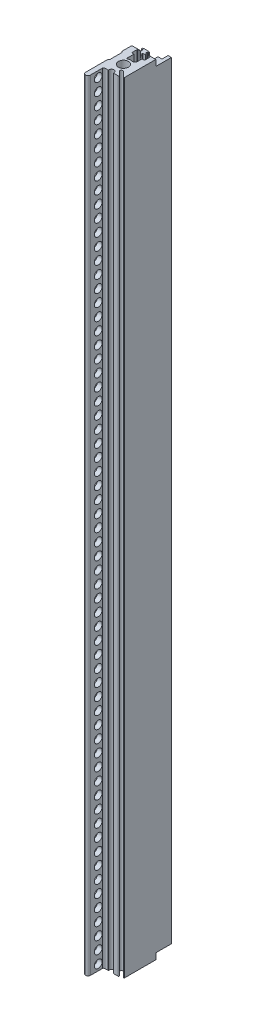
SolidWorks part; units mm, degrees
ref_plane "前视基准面" through (0, 0, 0) normal (0, 0, 1) x (1, 0, 0)
ref_plane "上视基准面" through (0, 0, 0) normal (0, 1, 0) x (1, 0, 0)
ref_plane "右视基准面" through (0, 0, 0) normal (1, 0, 0) x (0, 0, -1)
sketch "草图1" plane through (0, 0, 0) normal (0, 1, 0) x (1, 0, 0)
  line L0 (-4.2, 11.9) -> (-3.9, 11.9)
  line L1 (-4.4, 12.2) -> (-4.4, 12.1)
  line L2 (-4.0328, 12.4) -> (-4.2, 12.4)
  line L3 (-3.85, 12.5) -> (-3.8914, 12.4586)
  line L4 (-2.05, 12.5) -> (-3.85, 12.5)
  line L5 (-2.0086, 12.4586) -> (-2.05, 12.5)
  line L6 (-1.7, 12.4) -> (-1.8672, 12.4)
  line L7 (-1.5, 12.1) -> (-1.5, 12.2)
  line L8 (-1.8, 11.9) -> (-1.7, 11.9)
  line L9 (-2, 11.4828) -> (-2, 11.7)
  line L10 (-1.3586, 10.7586) -> (-1.9414, 11.3414)
  line L11 (-1.3, 10.55) -> (-1.3, 10.6172)
  line L12 (-3.7, 11.7) -> (-3.7, 9.95)
  line L13 (-5, -10.75) -> (-5, -1.6)
  line L14 (-3, -10.75) -> (-3, -5.75)
  line L15 (-2.5, -5.25) -> (-1.15, -5.25)
  line L16 (1.6887, -3.3855) -> (3.2118, -4.9086)
  line L17 (2.5373, -2.537) -> (4.6586, -4.6583)
  line L18 (5, 15) -> (5, 5.1793)
  line L19 (3.6, 15) -> (5, 15)
  line L20 (3.6, 12.5) -> (3.6, 15)
  line L21 (1.95, 12.5) -> (3.6, 12.5)
  line L22 (1.95, 10.55) -> (1.95, 12.5)
  line L23 (2.85, 10.55) -> (1.95, 10.55)
  line L24 (2.85, 9.35) -> (2.85, 10.55)
  line L25 (1.95, 9.35) -> (2.85, 9.35)
  line L26 (1.95, 8.35) -> (1.95, 9.35)
  line L27 (2.85, 8.35) -> (1.95, 8.35)
  line L28 (2.85, 6.05) -> (2.85, 8.35)
  line L29 (1.95, 6.05) -> (2.85, 6.05)
  line L30 (1.95, 3.8856) -> (1.95, 6.05)
  line L31 (-1.45, 6.05) -> (-1.45, 2.9458)
  line L32 (-2.35, 6.05) -> (-1.45, 6.05)
  line L33 (-2.35, 8.35) -> (-2.35, 6.05)
  line L34 (-1.45, 8.35) -> (-2.35, 8.35)
  line L35 (-1.45, 9.35) -> (-1.45, 8.35)
  line L36 (-2.35, 9.35) -> (-1.45, 9.35)
  line L37 (-2.35, 10.55) -> (-2.35, 9.35)
  line L38 (-1.3, 10.55) -> (-2.35, 10.55)
  line L39 (-4.45, 7.7) -> (-4.7, 7.7) construction
  line L40 (-5, 7.4) -> (-4.7, 7.7) construction
  line L41 (-5, 4.4) -> (-5, 7.4)
  line L42 (-4.5499, 3.8998) -> (-5, 4.4)
  line L43 (-4.45, 8.5) -> (-4.45, 9.55)
  line L44 (-3.9, 9.75) -> (-4.25, 9.75)
  line L45 (-4.5499, 3.8998) -> (-4.5501, -1.1002)
  line L46 (-5, -1.6) -> (-4.5501, -1.1002)
  line L47 (4.9414, -1.9395) -> (4.2929, -1.291) construction
  line L48 (5, -2.081) -> (5, -4.5169)
  line L49 (0, 0) -> (0, -5) construction
  line L50 (4, -0.5839) -> (4, 3.6823) construction
  line L51 (-1.05, -5) -> (-1.05, -5.15)
  line L52 (1.05, -5) -> (1.05, -5.15)
  line L53 (1.15, -5.25) -> (3.0703, -5.25)
  line L54 (2.5373, -2.537) -> (1.6887, -3.3855) construction
  line L55 (5, 5.1793) -> (5, -2.081)
  line L56 (-4.45, 8.5) -> (-4.7, 8.5)
  line L57 (-4.7, 8.5) -> (-5, 8.2)
  line L58 (4.9414, 5.0379) -> (4.2929, 4.3894) construction
  line L59 (-5, 8.2) -> (-5, 7.4)
  circle A0 centre (0, 0) radius 1.6
  arc A1 (-4.4, 12.1) -> (-4.2, 11.9) centre (-4.2, 12.1) ccw
  arc A2 (-4.2, 12.4) -> (-4.4, 12.2) centre (-4.2, 12.2) ccw
  arc A3 (-4.0328, 12.4) -> (-3.8914, 12.4586) centre (-4.0328, 12.6) ccw
  arc A4 (-2.0086, 12.4586) -> (-1.8672, 12.4) centre (-1.8672, 12.6) ccw
  arc A5 (-1.5, 12.2) -> (-1.7, 12.4) centre (-1.7, 12.2) ccw
  arc A6 (-1.7, 11.9) -> (-1.5, 12.1) centre (-1.7, 12.1) ccw
  arc A7 (-1.8, 11.9) -> (-2, 11.7) centre (-1.8, 11.7) ccw
  arc A8 (-2, 11.4828) -> (-1.9414, 11.3414) centre (-1.8, 11.4828) ccw
  arc A9 (-1.3, 10.6172) -> (-1.3586, 10.7586) centre (-1.5, 10.6172) ccw
  arc A10 (-5, -10.75) -> (-3, -10.75) centre (-4, -10.75) ccw
  arc A11 (3.0703, -5.25) -> (3.2118, -4.9086) centre (3.0703, -5.05) ccw
  arc A12 (-4.25, 9.75) -> (-4.45, 9.55) centre (-4.25, 9.55) ccw
  arc A13 (-3.9, 9.75) -> (-3.7, 9.95) centre (-3.9, 9.95) ccw
  arc A14 (5, -2.081) -> (4.9414, -1.9395) centre (4.8, -2.081) ccw construction
  arc A15 (4.9414, 5.0379) -> (5, 5.1793) centre (4.8, 5.1793) ccw construction
  arc A16 (4.6586, -4.6583) -> (5, -4.5169) centre (4.8, -4.5169) ccw
  arc A17 (2.5373, -2.537) -> (1.6887, -3.3855) centre (2.113, -2.9613) ccw
  arc A18 (0.7125, 2.9142) -> (-1.1719, 2.7616) centre (0, 0) ccw
  arc A19 (-1.45, 2.9458) -> (-1.1719, 2.7616) centre (-1.25, 2.9458) ccw
  arc A20 (0.7125, 2.9142) -> (1.95, 3.8856) centre (0.95, 3.8856) ccw
  arc A21 (-3.7, 11.7) -> (-3.9, 11.9) centre (-3.9, 11.7) ccw
  arc A22 (4.2929, -1.291) -> (4, -0.5839) centre (5, -0.5839) cw construction
  arc A23 (4, 3.6823) -> (4.2929, 4.3894) centre (5, 3.6823) cw construction
  arc A24 (1.05, -5) -> (-1.05, -5) centre (0, -5) ccw
  arc A25 (1.15, -5.25) -> (1.05, -5.15) centre (1.15, -5.15) cw
  arc A26 (-1.05, -5.15) -> (-1.15, -5.25) centre (-1.15, -5.15) cw
  arc A29 (-3, -5.75) -> (-2.5, -5.25) centre (-2.5, -5.75) cw
  point P104 (1.05, -5.25)
  dimension "D1" = 3.2
  dimension "D2" = 2.1
  dimension "D3" = 5.2
  dimension "D4" = 45
  dimension "D5" = 1.2
  dimension "D7" = 0.6
  dimension "D8" = 0.2
  dimension "D10" = 5
  dimension "D11" = 0.1
  dimension "D12" = 0.25
  dimension "D6" = 3
  dimension "D9" = 2.1225
  dimension "D13" = 0.8
extrude "凸台-拉伸1" add sketch "草图1" along normal mid plane 325.12
sketch "草图7" plane through (0, 162.56, 0) normal (0, 1, 0) x (1, 0, 0)
  line L0 (1.95, 8.35) -> (2.85, 8.35) construction
  line L1 (2.95, 8.35) -> (-2.45, 8.35)
  line L2 (2.95, 8.35) -> (2.95, 5.85)
  line L3 (2.95, 5.85) -> (-2.45, 5.85)
  line L4 (-2.45, 8.35) -> (-2.45, 5.85)
  line L5 (1.95, 10.55) -> (2.85, 10.55) construction
  line L6 (2.95, 10.55) -> (-2.45, 10.55)
  line L7 (2.95, 10.55) -> (2.95, 9.35)
  line L8 (2.95, 9.35) -> (-2.45, 9.35)
  line L9 (-2.45, 10.55) -> (-2.45, 9.35)
  line L10 (-1.45, 9.35) -> (-2.35, 9.35) construction
  line L11 (2.85, 8.35) -> (2.85, 6.05) construction
  line L12 (-2.35, 6.05) -> (-2.35, 8.35) construction
  line L13 (-1.45, 6.05) -> (-2.35, 6.05) construction
  dimension "D1" = 0.1
  dimension "D2" = 0.1
  dimension "D3" = 0.2
extrude "切除-拉伸6" cut sketch "草图7" against normal through all
fillet "圆角1" radius 0.2 8 edges at (2.95, 0, -5.85) (2.95, 0, -8.35) (-2.45, 0, -5.85) (-2.45, 0, -8.35) (-2.45, 0, -9.35) (-2.45, 0, -10.55) (2.95, 0, -9.35) (2.95, 0, -10.55)
sketch "草图2" plane through (0, 162.56, 0) normal (0, 1, 0) x (1, 0, 0)
  circle A0 centre (0, 0) radius 2.1
  dimension "D1" = 4.2
extrude "切除-拉伸1" cut sketch "草图2" against normal blind 10
sketch "草图3" plane through (0, -162.56, 0) normal (0, -1, 0) x (1, 0, 0)
  circle A0 centre (0, 0) radius 2.1
  dimension "D1" = 4.2
extrude "切除-拉伸2" cut sketch "草图3" against normal blind 10
sketch "草图4" plane through (-5, 0, 0) normal (-1, 0, 0) x (0, 0, 1)
  line L0 (1.6, -162.56) -> (10.75, -162.56) construction
  line L1 (11.75, -162.56) -> (11.75, 162.56) construction
  circle A0 centre (7.5, -160.02) radius 1.65
  circle A1 centre (7.5, -154.94) radius 1.65
  circle A2 centre (7.5, -149.86) radius 1.65
  circle A3 centre (7.5, -144.78) radius 1.65
  circle A4 centre (7.5, -139.7) radius 1.65
  circle A5 centre (7.5, -134.62) radius 1.65
  circle A6 centre (7.5, -129.54) radius 1.65
  circle A7 centre (7.5, -124.46) radius 1.65
  circle A8 centre (7.5, -119.38) radius 1.65
  circle A9 centre (7.5, -114.3) radius 1.65
  circle A10 centre (7.5, -109.22) radius 1.65
  circle A11 centre (7.5, -104.14) radius 1.65
  circle A12 centre (7.5, -99.06) radius 1.65
  circle A13 centre (7.5, -93.98) radius 1.65
  circle A14 centre (7.5, -88.9) radius 1.65
  circle A15 centre (7.5, -83.82) radius 1.65
  circle A16 centre (7.5, -78.74) radius 1.65
  circle A17 centre (7.5, -73.66) radius 1.65
  circle A18 centre (7.5, -68.58) radius 1.65
  circle A19 centre (7.5, -63.5) radius 1.65
  circle A20 centre (7.5, -58.42) radius 1.65
  circle A21 centre (7.5, -53.34) radius 1.65
  circle A22 centre (7.5, -48.26) radius 1.65
  circle A23 centre (7.5, -43.18) radius 1.65
  circle A24 centre (7.5, -38.1) radius 1.65
  circle A25 centre (7.5, -33.02) radius 1.65
  circle A26 centre (7.5, -27.94) radius 1.65
  circle A27 centre (7.5, -22.86) radius 1.65
  circle A28 centre (7.5, -17.78) radius 1.65
  circle A29 centre (7.5, -12.7) radius 1.65
  circle A30 centre (7.5, -7.62) radius 1.65
  circle A31 centre (7.5, -2.54) radius 1.65
  circle A32 centre (7.5, 2.54) radius 1.65
  circle A33 centre (7.5, 7.62) radius 1.65
  circle A34 centre (7.5, 12.7) radius 1.65
  circle A35 centre (7.5, 17.78) radius 1.65
  circle A36 centre (7.5, 22.86) radius 1.65
  circle A37 centre (7.5, 27.94) radius 1.65
  circle A38 centre (7.5, 33.02) radius 1.65
  circle A39 centre (7.5, 38.1) radius 1.65
  circle A40 centre (7.5, 43.18) radius 1.65
  circle A41 centre (7.5, 48.26) radius 1.65
  circle A42 centre (7.5, 53.34) radius 1.65
  circle A43 centre (7.5, 58.42) radius 1.65
  circle A44 centre (7.5, 63.5) radius 1.65
  circle A45 centre (7.5, 68.58) radius 1.65
  circle A46 centre (7.5, 73.66) radius 1.65
  circle A47 centre (7.5, 78.74) radius 1.65
  circle A48 centre (7.5, 83.82) radius 1.65
  circle A49 centre (7.5, 88.9) radius 1.65
  circle A50 centre (7.5, 93.98) radius 1.65
  circle A51 centre (7.5, 99.06) radius 1.65
  circle A52 centre (7.5, 104.14) radius 1.65
  circle A53 centre (7.5, 109.22) radius 1.65
  circle A54 centre (7.5, 114.3) radius 1.65
  circle A55 centre (7.5, 119.38) radius 1.65
  circle A56 centre (7.5, 124.46) radius 1.65
  circle A57 centre (7.5, 129.54) radius 1.65
  circle A58 centre (7.5, 134.62) radius 1.65
  circle A59 centre (7.5, 139.7) radius 1.65
  circle A60 centre (7.5, 144.78) radius 1.65
  circle A61 centre (7.5, 149.86) radius 1.65
  circle A62 centre (7.5, 154.94) radius 1.65
  circle A63 centre (7.5, 160.02) radius 1.65
  circle A64 centre (7.5, 165.1) radius 1.65
  circle A65 centre (7.5, 170.18) radius 1.65
  circle A66 centre (7.5, 175.26) radius 1.65
  circle A67 centre (7.5, 180.34) radius 1.65
  circle A68 centre (7.5, 185.42) radius 1.65
  circle A69 centre (7.5, 190.5) radius 1.65
  circle A70 centre (7.5, 195.58) radius 1.65
  circle A71 centre (7.5, 200.66) radius 1.65
  circle A72 centre (7.5, 205.74) radius 1.65
  circle A73 centre (7.5, 210.82) radius 1.65
  circle A74 centre (7.5, 215.9) radius 1.65
  circle A75 centre (7.5, 220.98) radius 1.65
  circle A76 centre (7.5, 226.06) radius 1.65
  circle A77 centre (7.5, 231.14) radius 1.65
  circle A78 centre (7.5, 236.22) radius 1.65
  circle A79 centre (7.5, 241.3) radius 1.65
  circle A80 centre (7.5, 246.38) radius 1.65
  circle A81 centre (7.5, 251.46) radius 1.65
  circle A82 centre (7.5, 256.54) radius 1.65
  circle A83 centre (7.5, 261.62) radius 1.65
  circle A84 centre (7.5, 266.7) radius 1.65
  dimension "D1" = 2.54
  dimension "D2" = 4.25
  dimension "D3" = 3.3
  dimension "D5" = 5.08
  dimension "D4" = 85
extrude "切除-拉伸3" cut sketch "草图4" against normal blind 12
sketch "草图5" plane through (5, 0, 0) normal (1, 0, 0) x (0, 0, -1)
  line L0 (15, 0) -> (41.1348, 0) construction
  line L1 (15, 162.56) -> (8.5, 162.56)
  line L2 (15, 162.56) -> (15, 160.02)
  line L3 (15, 160.02) -> (8.5, 160.02)
  line L4 (8.5, 162.56) -> (8.5, 160.02)
  line L5 (15, 162.56) -> (15, -162.56) construction
  line L6 (8.5, -162.56) -> (8.5, -160.02)
  line L7 (15, -160.02) -> (8.5, -160.02)
  line L8 (15, -162.56) -> (15, -160.02)
  line L9 (15, -162.56) -> (8.5, -162.56)
  dimension "D1" = 6.5
  dimension "D2" = 2.54
extrude "切除-拉伸4" cut sketch "草图5" against normal blind 10
